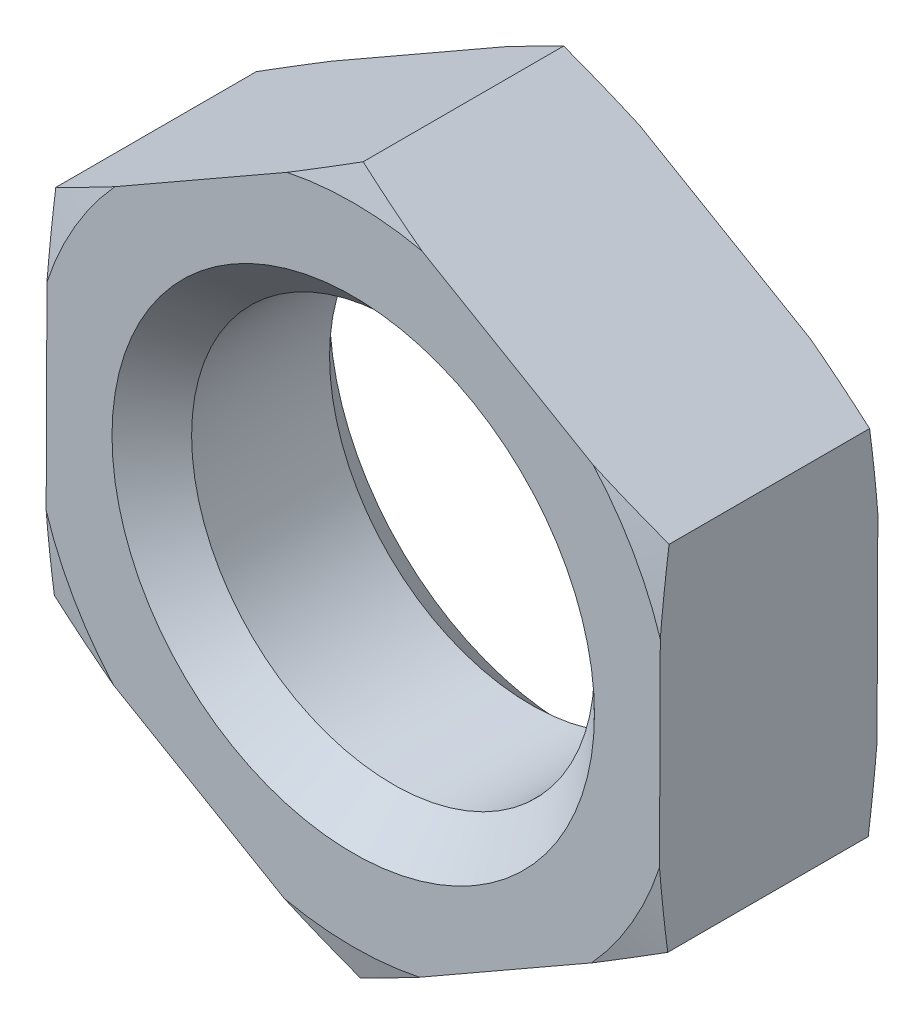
SolidWorks part; units mm, degrees
extrude "基体-拉伸" add sketch "草图1" along normal blind 2.7
sketch "草图1" plane through (0, 0, 0) normal (0, 0, 1) x (1, 0, 0)
  line L0 (-26.8088, 0) -> (37.1748, 0) construction
  line L1 (0, 25.0215) -> (0, -25.0215) construction
  line L3 (0.0173, 4.395) -> (-3.7975, 2.2125)
  line L4 (-3.7975, 2.2125) -> (-3.8148, -2.1825)
  line L5 (-3.8148, -2.1825) -> (-0.0173, -4.395)
  line L6 (-0.0173, -4.395) -> (3.7975, -2.2125)
  line L7 (3.7975, -2.2125) -> (3.8148, 2.1825)
  line L8 (3.8148, 2.1825) -> (0.0173, 4.395)
  circle A0 centre (0, 0) radius 3.8062 construction
  circle A1 centre (0, 0) radius 2.5
chamfer "倒角1" distance 0.494 angle 45 2 edges at (2.5, 0, 0) (2.5, 0, 2.7)
ref_plane "基准面1" through (0, 0, 0) normal (0, 0, 1) x (1, 0, 0)
ref_plane "基准面2" through (0, 0, 0) normal (0, 1, 0) x (1, 0, 0)
ref_plane "基准面3" through (0, 0, 0) normal (1, 0, 0) x (0, 0, -1)
sketch "尺寸草图" plane through (0, 0, 0) normal (0, 0, 1) x (1, 0, 0)
  line L0 (0, 0) -> (24.1005, 0)
  line L1 (0, 0) -> (5.75, 0)
  line L2 (46.8781, 0) -> (53.7781, 0)
  line L3 (-4.7619, 0) -> (0, 0)
  point P3 (5, 0)
  point P4 (2.5, 0)
  point P5 (8.79, 0)
  point P6 (2.7, 0)
  point P7 (7.3, 0)
  point P8 (8, 0)
sketch "草图2" plane through (0, 0, 0) normal (0, 0, -1) x (-1, 0, 0)
  circle A0 centre (0, 0) radius 4
  circle A1 centre (0, 0) radius 2.5 construction
extrude "切除-拉伸1" cut sketch "草图2" against normal through all draft 75 flip side to cut
sketch "草图3" plane through (0, 0, 2.7) normal (0, 0, 1) x (1, 0, 0)
  circle A0 centre (0, 0) radius 4
extrude "切除-拉伸2" cut sketch "草图3" against normal through all draft 75 flip side to cut
equation "\"e@草图1\" = \"e@尺寸草图\""
equation "\"D1@尺寸草图\" = \"D@尺寸草图\" / 1.05"
equation "\"D@草图1\" = \"D@尺寸草图\""
equation "\"m@基体-拉伸\" = \"m@尺寸草图\""
equation "\"D1@草图3\" = \"s@尺寸草图\""
equation "\"s@草图2\" = \"s@尺寸草图\""
equation "\"D2@装饰螺纹线1\" = 1.05 * \"D1@尺寸草图\""
equation "\"D1@倒角1\" =  ( \"da@尺寸草图\" - \"D1@尺寸草图\" )  / 2"
